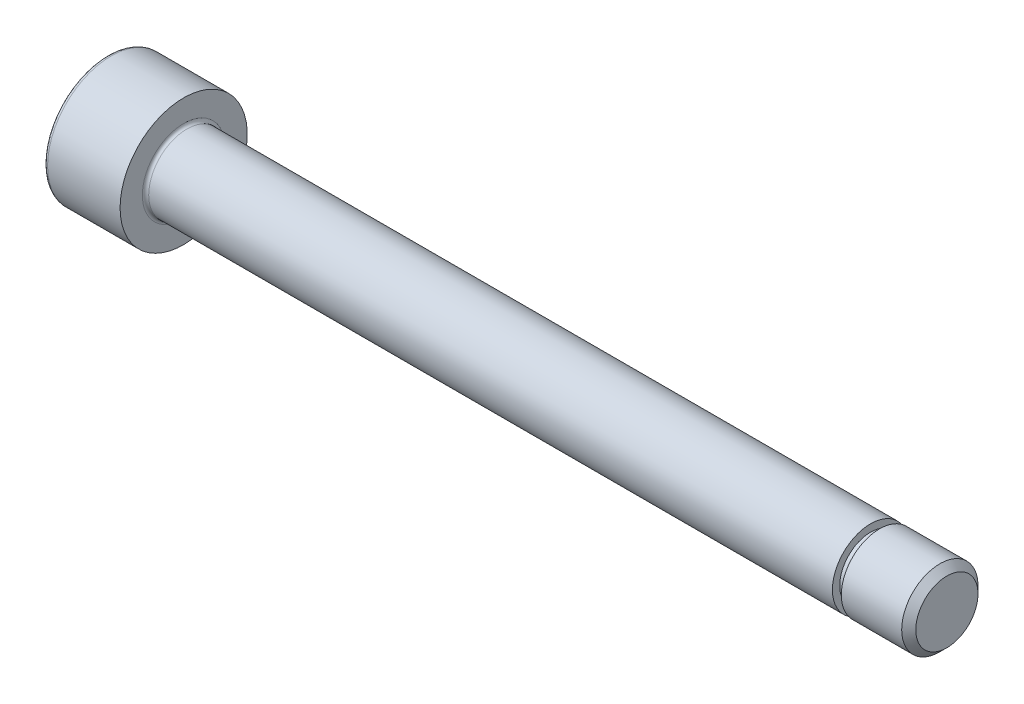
SolidWorks part; units mm, degrees
ref_plane "Plane1" through (0, 0, 0) normal (0, 0, 1) x (1, 0, 0)
ref_plane "Plane2" through (0, 0, 0) normal (0, 1, 0) x (1, 0, 0)
ref_plane "Plane3" through (0, 0, 0) normal (1, 0, 0) x (0, 0, -1)
revolve "Base-Revolve" add sketch "BodySke"
sketch "BodySke" plane through (0, 0, 0) normal (0, 0, 1) x (1, 0, 0)
  line L0 (0, 0) -> (0, 5)
  line L1 (0, 5) -> (6, 5)
  line L2 (6, 5) -> (6, 3)
  line L3 (6, 3) -> (65.4455, 3)
  line L4 (66, 2.4455) -> (66, 0)
  line L5 (66, 0) -> (0, 0)
  line L6 (-31.75, 0) -> (127, 0) construction
  line L8 (66, 2.4455) -> (65.4455, 3)
  line L10 (66, -2.4455) -> (65.4455, -3) construction
  line L11 (7, 9.525) -> (7, 3.175) construction
  line L12 (42, 9.525) -> (42, 3.175) construction
  line L13 (6, 9.525) -> (6, 3.175) construction
  dimension "Diameter" = 6
  dimension "Head_ht" = 6
  dimension "Length" = 60
  dimension "Body_ch_ang" = 45
  dimension "Head_dia" = 10
  dimension "Minor_dia" = 4.891
  dimension "Advance" = 1
  dimension "Thread_nom" = 24
  dimension "Thread_length" = 60
fillet "Fillet1" radius 0.25 1 edges at (6, 0, 3)
fillet "Fillet2" radius 0.3 1 edges at (0, 0, 5)
sketch "Sketch2" plane through (0, 0, 0) normal (0, 0, 1) x (1, 0, 0)
  line L0 (0, 2.542) -> (3, 2.542)
  line L1 (3, 2.542) -> (4.4676, 0)
  line L2 (-31.75, 0) -> (127, 0) construction
  line L3 (4.4676, 0) -> (0, 0)
  line L4 (0, 0) -> (0, 2.542)
  line L6 (0, 0) -> (47.625, 0) construction
  dimension "D1" = 2.542
  dimension "D2" = 60
  dimension "Depth" = 3
revolve "Hex-PreBroach" cut sketch "Sketch2" angle 360 about L6
sketch "Sketch3" plane through (0, 0, 0) normal (-1, 0, 0) x (0, 0.5, 0.866)
  line L0 (1.4676, 2.542) -> (-1.4676, 2.542)
  line L1 (-1.4676, 2.542) -> (-2.9352, 0)
  line L2 (1.4676, 2.542) -> (2.9352, 0)
  line L3 (1.4676, -2.542) -> (2.9352, 0)
  line L4 (1.4676, -2.542) -> (-1.4676, -2.542)
  line L5 (-1.4676, -2.542) -> (-2.9352, 0)
  dimension "D1" = 2.542
  dimension "D2" = 2.542
  dimension "Hex_size" = 5.084
extrude "Hex" cut sketch "Sketch3" against normal blind 3
sketch "ThdSchSke" plane through (0, 0, 0) normal (0, 0, 1) x (1, 0, 0)
  line L0 (42, -2.4455) -> (41.6117, -3)
  line L1 (42, -2.4455) -> (42.3883, -3)
  line L2 (42.3883, -3) -> (42.3883, -3.75)
  line L3 (-3.175, 0) -> (5.1513, 0) construction
  line L4 (0, 4.7) -> (0, -4.7) construction
  line L5 (42.3883, -3.75) -> (41.6117, -3.75)
  line L6 (41.6117, -3.75) -> (41.6117, -3)
  dimension "Thread_minor" = 4.891
  dimension "Diameter" = 6
  dimension "Start" = 42
  dimension "SideAngle" = 55
  dimension "VeeAngle" = 70
  dimension "Overcut" = 7.5
revolve "ThreadSchematic" cut sketch "ThdSchSke" angle 360 about L3
pattern_linear "ThdSchPat"
sketch "Esquisse1" plane through (0, 0, 0) normal (0, 0, 1) x (1, 0, 0)
  line L0 (66.3672, 0) -> (59.4737, 0) construction
  line L1 (60, 5.956) -> (60.7, 5.956)
  line L2 (60, 5.956) -> (60, 2.425)
  line L3 (60, 2.425) -> (60.7, 2.425)
  line L4 (60.7, 5.956) -> (60.7, 2.425)
  line L5 (66, -2.4455) -> (66, 2.4455) construction
  dimension "D1" = 6
  dimension "D2" = 0.7
  dimension "D3" = 2.425
revolve "Enlèvement de matière-Révolution1" cut sketch "Esquisse1" angle 360 about L0
equation "\"D2@Sketch3\" = \"Hex_size@Sketch3\" / 2"
equation "\"D1@Sketch3\" = \"Hex_size@Sketch3\" / 2"
equation "\"D1@Sketch2\" = \"Hex_size@Sketch3\" / 2"
equation "\"Thread_minor@ThreadCosmetic\"  =  \"Minor_dia@BodySke\""
equation "\"Depth@Sketch2\" =  \"Key_eng@Hex\""
equation "\"Thread_length@ThreadCosmetic\" = ((sgn( (\"Length@BodySke\" - \"Advance@BodySke\" * 3.0) - \"Thread_nom@BodySke\" )-1)*( (\"Length@BodySke\" - \"Advance@BodySke\" * 3.0) - \"Thread_nom@BodySke\" ))/-2+ \"Thread_no"
equation "\"Thread_minor@ThdSchSke\" = \"Minor_dia@BodySke\""
equation "\"Diameter@ThdSchSke\" = \"Diameter@BodySke\""
equation "\"Overcut@ThdSchSke\" = \"Diameter@BodySke\" * 1.25"
equation "\"Start@ThdSchSke\" = \"Head_ht@BodySke\" + \"Length@BodySke\" - \"Thread_length@ThreadCosmetic\"  '---Non-countersunk---"
equation "\"Num_threads@ThdSchPat\" = int( \"Thread_length@ThreadCosmetic\" / \"Advance@BodySke\" + 0.999 )  + 1"
equation "\"Advance@ThdSchPat\" = \"Thread_length@ThreadCosmetic\" /  (\"Num_threads@ThdSchPat\" - 1) 'relax it"
equation "\"Num_threads@ThdSchPat\" = \"Num_threads@ThdSchPat\" - sgn( \"Num_threads@ThdSchPat\" - 1) '---chamfered tips only---"
